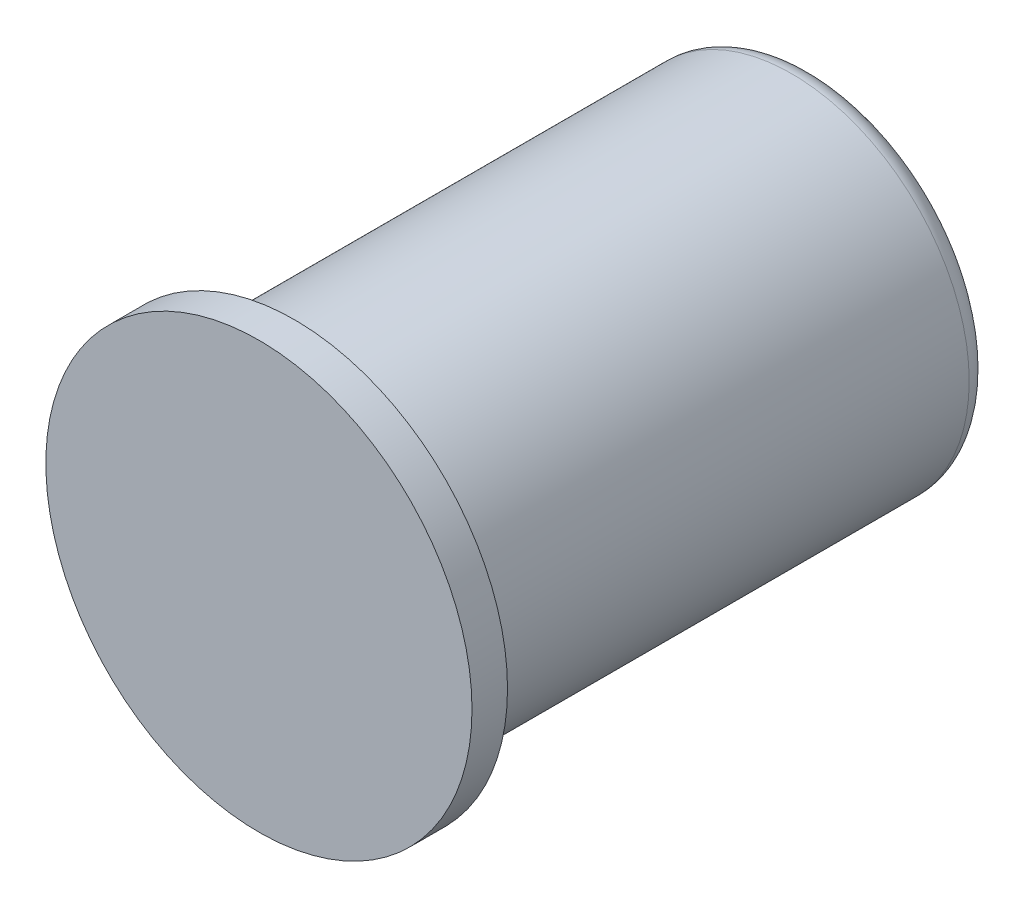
SolidWorks part; units mm, degrees
ref_plane "Front Plane" through (0, 0, 0) normal (0, 0, 1) x (1, 0, 0)
ref_plane "Top Plane" through (0, 0, 0) normal (0, 1, 0) x (1, 0, 0)
ref_plane "Right Plane" through (0, 0, 0) normal (1, 0, 0) x (0, 0, -1)
sketch "Sketch1" plane through (0, 0, 0) normal (1, 0, 0) x (0, 0, -1)
  line L0 (0, 0) -> (40, 0) construction
  line L1 (0, 0) -> (0, 30)
  line L2 (0, 30) -> (5, 30)
  line L3 (5, 30) -> (5, 25)
  line L4 (5, 25) -> (75, 25)
  line L5 (78, 22) -> (78, 4.5)
  line L6 (77.5, 4) -> (69, 4)
  line L7 (69, 4) -> (66.6906, 0)
  line L8 (78, 4.5) -> (77.5, 4)
  line L9 (0, 0) -> (66.6906, 0)
  arc A0 (75, 25) -> (78, 22) centre (75, 22) cw
  dimension "D1" = 3
  dimension "D2" = 73
  dimension "D3" = 25
  dimension "D4" = 30
  dimension "D5" = 5
  dimension "D6" = 0.5
  dimension "D7" = 45
  dimension "D8" = 4
  dimension "D9" = 60
  dimension "D10" = 9
revolve "Revolve1" add sketch "Sketch1" angle 360 about L0
